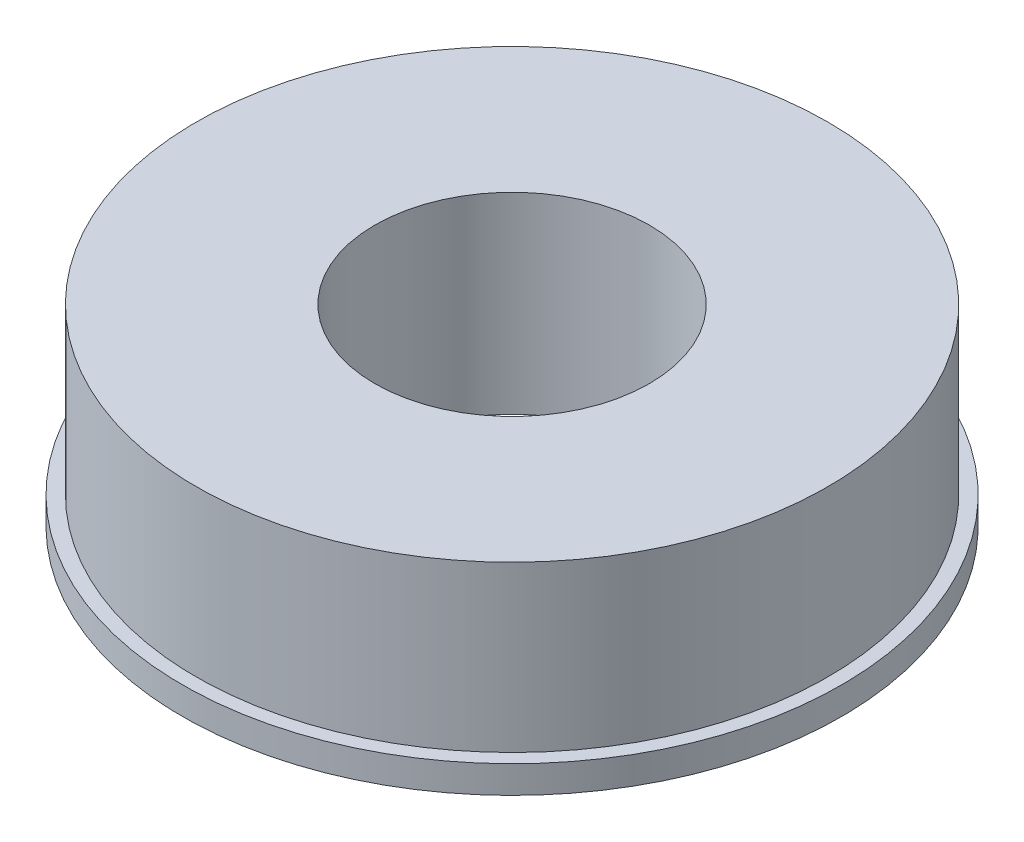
SolidWorks part; units mm, degrees
ref_plane "Front Plane" through (0, 0, 0) normal (0, 0, 1) x (1, 0, 0)
ref_plane "Top Plane" through (0, 0, 0) normal (0, 1, 0) x (1, 0, 0)
ref_plane "Right Plane" through (0, 0, 0) normal (1, 0, 0) x (0, 0, -1)
sketch "Sketch1" plane through (0, 0, 0) normal (0, 0, 1) x (1, 0, 0)
  line L0 (5, 0) -> (12, 0)
  line L1 (12, 0) -> (12, 1)
  line L2 (12, 1) -> (11.5, 1)
  line L3 (11.5, 1) -> (11.5, 7)
  line L4 (11.5, 7) -> (5, 7)
  line L5 (5, 7) -> (5, 0)
  line L6 (0, 7) -> (0, 0) construction
revolve "Revolve1" add sketch "Sketch1" angle 360 about L6
